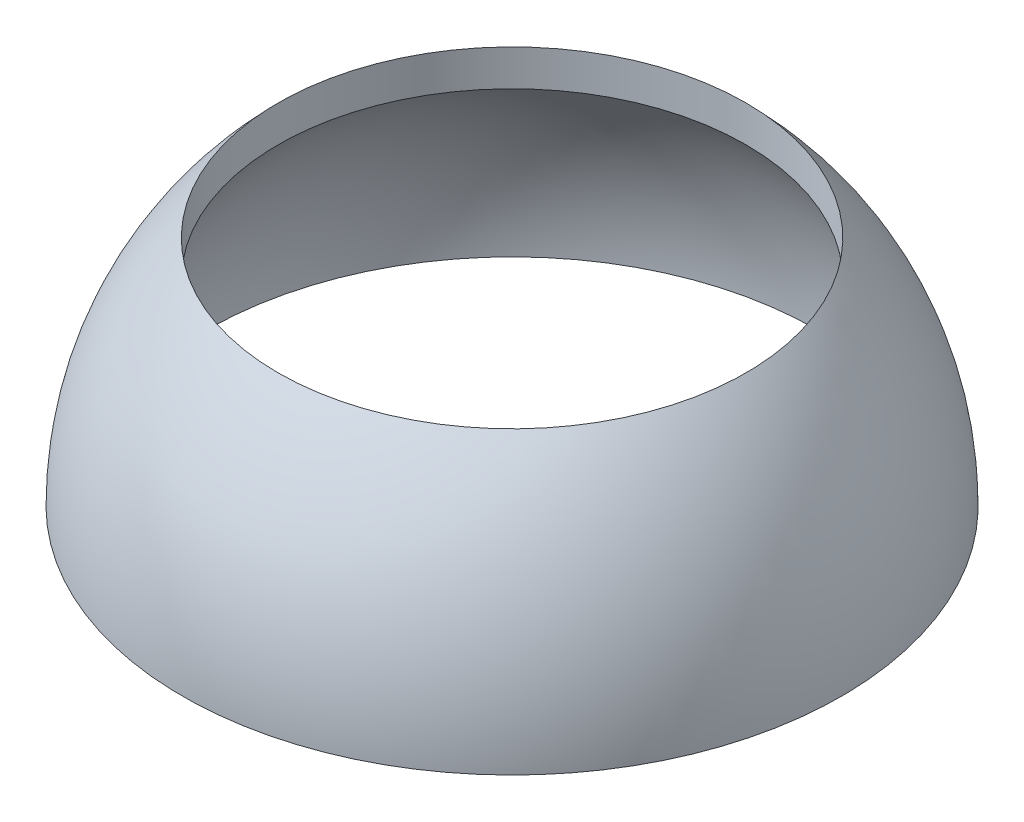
SolidWorks part; units mm, degrees
ref_plane "Alzado" through (0, 0, 0) normal (0, 0, 1) x (1, 0, 0)
ref_plane "Planta" through (0, 0, 0) normal (0, 1, 0) x (1, 0, 0)
ref_plane "Vista lateral" through (0, 0, 0) normal (1, 0, 0) x (0, 0, -1)
sketch "Croquis1" plane through (0, 0, 0) normal (0, 0, 1) x (1, 0, 0)
  line L0 (0, 0) -> (0, 10.5786) construction
  line L1 (0, 14.35) -> (0, 15.5)
  line L2 (14.35, 0) -> (15.5, 0)
  arc A0 (15.5, 0) -> (0, 15.5) centre (0, 0) ccw
  arc A1 (14.35, 0) -> (0, 14.35) centre (0, 0) ccw
  dimension "D1" = 28.7
  dimension "D2" = 31
revolve "Revolución1" add sketch "Croquis1" angle 360 about L0
sketch "Croquis2" plane through (0, 0, 0) normal (0, -1, 0) x (1, 0, 0)
  circle A0 centre (0, 0) radius 11
  dimension "D1" = 22
extrude "Cortar-Extruir1" cut sketch "Croquis2" against normal up to next
